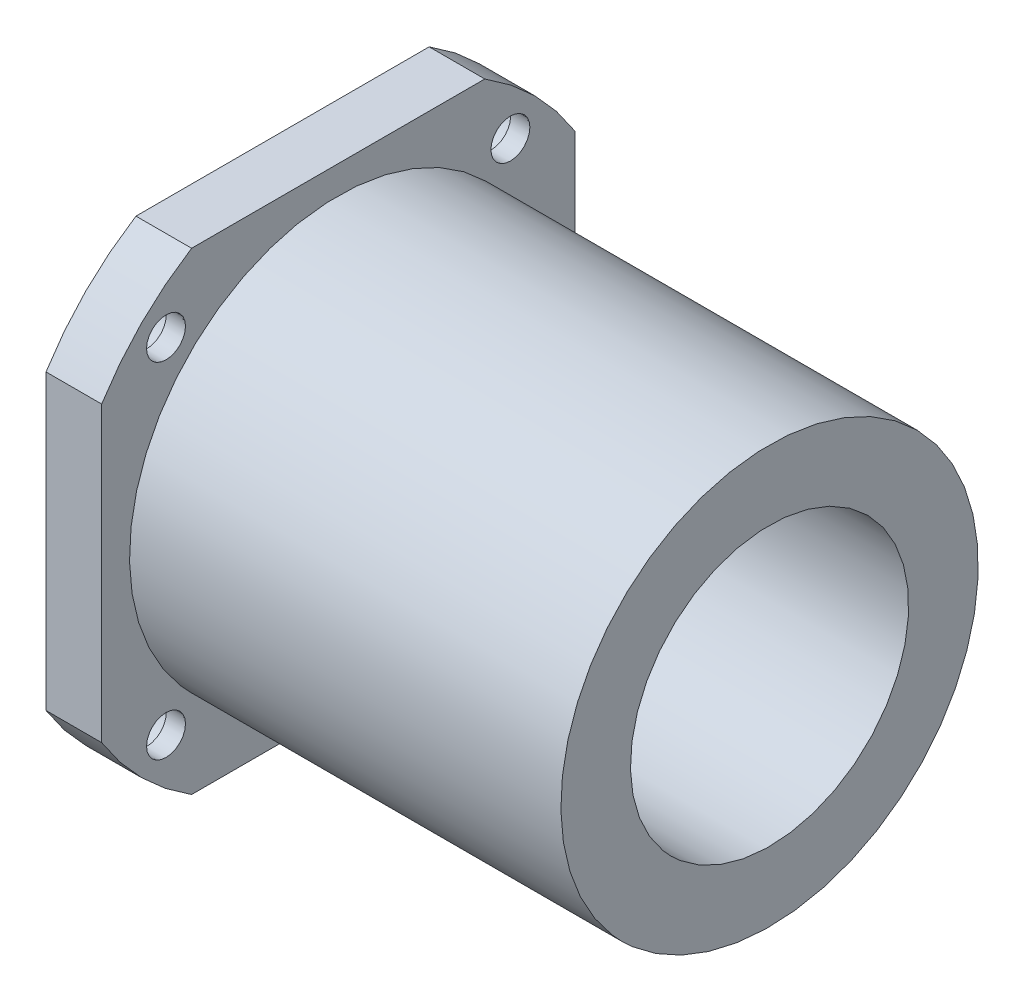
SolidWorks part; units mm, degrees
other "Solid1"
ref_plane "Front Plane" through (0, 0, 0) normal (0, 0, 1) x (1, 0, 0)
ref_plane "Top Plane" through (0, 0, 0) normal (0, 1, 0) x (1, 0, 0)
ref_plane "Right Plane" through (0, 0, 0) normal (1, 0, 0) x (0, 0, -1)
imported_body "2.7058 LMK100UU.stp<1>"
move or copy body "Body-Move/Copy1" bodies to move or copy 101 copy no rotation origin (0, 0, 0) rotation axis (1, 0, 0) rotation angle 45
